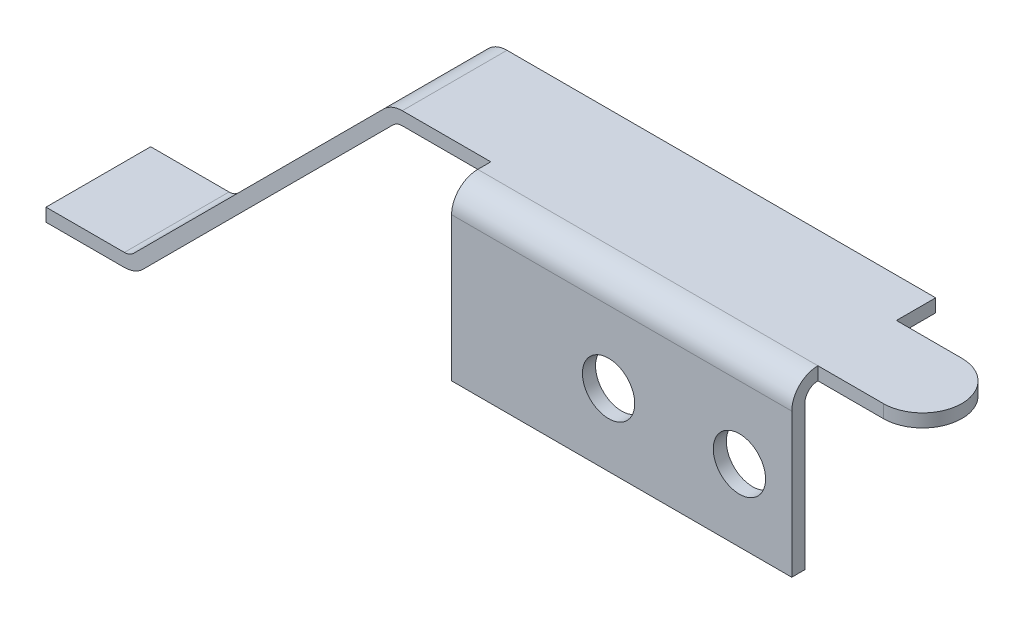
SolidWorks part; units mm, degrees
ref_plane "Face" through (0, 0, 0) normal (0, 0, 1) x (1, 0, 0)
ref_plane "Dessus" through (0, 0, 0) normal (0, 1, 0) x (1, 0, 0)
ref_plane "Droite" through (0, 0, 0) normal (1, 0, 0) x (0, 0, -1)
sketch "Esquisse1" plane through (0, 0, 0) normal (0, 0, 1) x (1, 0, 0)
  line L0 (0, 0) -> (2.9958, 0)
  line L1 (3.7029, 0.2929) -> (13.2636, 9.8536)
  line L2 (13.6171, 10) -> (30, 10)
  arc A0 (3.7029, 0.2929) -> (2.9958, 0) centre (2.9958, 1) cw
  arc A1 (13.2636, 9.8536) -> (13.6171, 10) centre (13.6171, 9.5) cw
  point P7 (3.41, 0)
  dimension "D5" = 1
  dimension "D6" = 0.5
  dimension "D1" = 3.41
  dimension "D2" = 30
  dimension "D3" = 10
  dimension "D4" = 225
extrude "Extru.-Mince1" add sketch "Esquisse1" along normal blind 4 thin
sketch "Esquisse2" plane through (0, 10.5, 0) normal (0, 1, 0) x (-1, 0, 0)
  line L1 (-30, 4) -> (-30, 0) construction
  line L2 (-32.5, 4.5) -> (-30, 4.5)
  line L3 (-30, 4.5) -> (-30, 1.5)
  line L4 (-30, 1.5) -> (-32.5, 1.5)
  line L5 (-13.6171, 0) -> (-30, 0) construction
  arc A0 (-32.5, 4.5) -> (-32.5, 1.5) centre (-32.5, 3) ccw
  dimension "D3" = 3
  dimension "D1" = 1.5
  dimension "D2" = 2.5
extrude "Extrusion1" add sketch "Esquisse2" against normal up to surface (0.5 mm away)
sketch "Esquisse3" plane through (30, 0, 0) normal (1, 0, 0) x (0, 0, -1)
  line L0 (-4, 10) -> (-4.5, 10)
  line L1 (-5, 9.5) -> (-5, 4)
  line L3 (-4, 0.2929) -> (-4, 9.8536) construction
  arc A0 (-4.5, 10) -> (-5, 9.5) centre (-4.5, 9.5) ccw
  point P8 (-5, 10)
  dimension "D3" = 0.5
  dimension "D1" = 1
  dimension "D2" = 6
extrude "Extru.-Mince2" add sketch "Esquisse3" against normal blind 13 thin
hole_wizard "Dégagement M21" positions "Esquisse5" profile "Esquisse4" hole size "M2" standard "Ansi Métrique"
sketch "Esquisse5" plane through (0, 0, 5.5) normal (0, 0, 1) x (1, 0, 0)
  line L0 (30, 9.5) -> (30, 4) construction
  line L1 (17, 10.5) -> (30, 10.5) construction
  point P0 (28, 6.75)
  point P1 (23, 6.75)
  dimension "D1" = 2
  dimension "D2" = 5
  dimension "D3" = 3.75
sketch "Esquisse4" plane through (28, 6.75, 5.5) normal (1, 0, 0) x (0, -1, 0)
  line L0 (0, 0) -> (0, 5.5)
  line L1 (0, 5.5) -> (1, 5.5)
  line L2 (1, 5.5) -> (1, 0)
  line L5 (1, 0) -> (0, 0)
  line L11 (0, -6.35) -> (0, 107.95) construction
  dimension "Diamètre du perçage jusqu'au prochain" = 2
  dimension "Profondeur du perçage jusqu'au prochain" = 5.5
